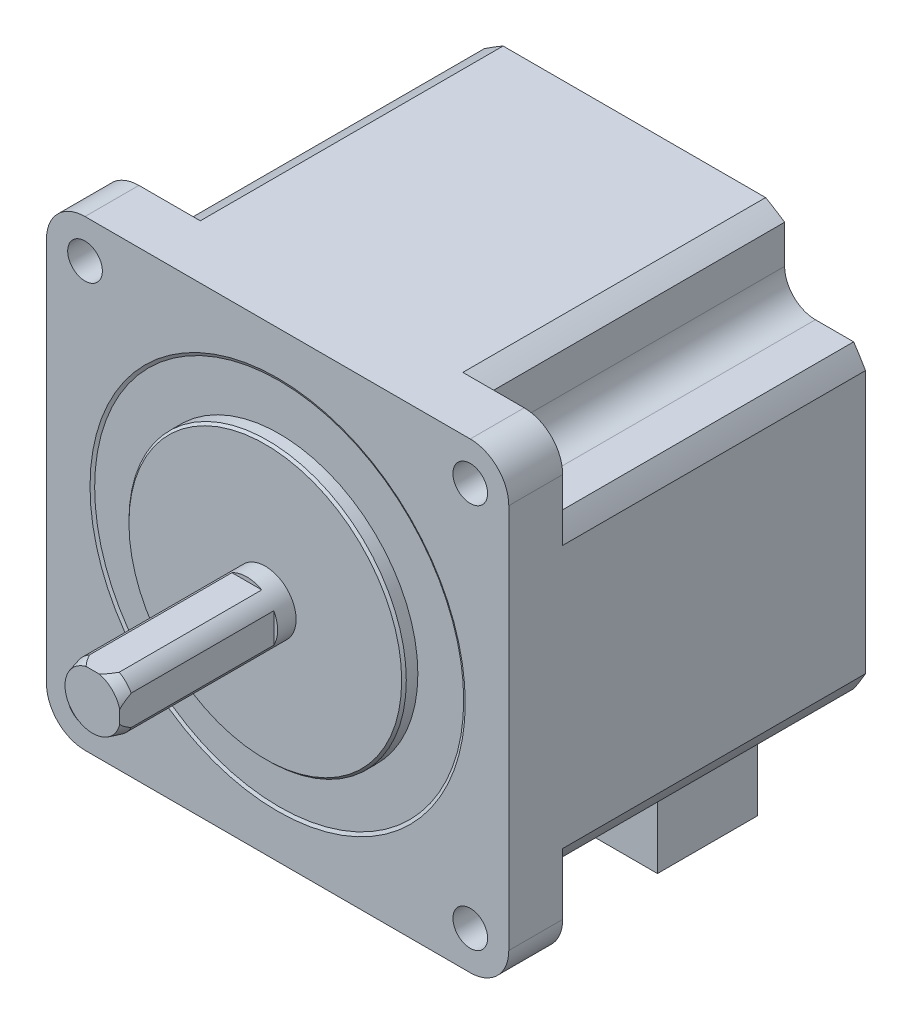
SolidWorks part; units mm, degrees
ref_plane "正面" through (0, 0, 0) normal (0, 0, 1) x (1, 0, 0)
ref_plane "平面" through (0, 0, 0) normal (0, 1, 0) x (1, 0, 0)
ref_plane "右側面" through (0, 0, 0) normal (1, 0, 0) x (0, 0, -1)
sketch "ｽｹｯﾁ1" plane through (0, 0, 0) normal (0, 0, 1) x (1, 0, 0)
  circle A0 centre (0, 0) radius 4
  dimension "D1" = 8
extrude "押し出し1" add sketch "ｽｹｯﾁ1" along normal blind 22.4
sketch "ｽｹｯﾁ2" plane through (0, 0, 0) normal (0, 0, -1) x (-1, 0, 0)
  circle A0 centre (0, 0) radius 18
  dimension "D1" = 36
extrude "押し出し2" add sketch "ｽｹｯﾁ2" along normal blind 1.6
sketch "ｽｹｯﾁ3" plane through (0, 0, -1.6) normal (0, 0, -1) x (-1, 0, 0)
  line L1 (-30, 30) -> (30, 30)
  line L2 (-30, 30) -> (-30, -30)
  line L3 (-30, -30) -> (30, -30)
  line L4 (30, 30) -> (30, -30)
  line L5 (-30, 30) -> (30, -30) construction
  line L6 (-30, -30) -> (30, 30) construction
  line L7 (25, 25) -> (-25, 25) construction
  line L8 (25, 25) -> (25, -25) construction
  line L9 (25, -25) -> (-25, -25) construction
  line L10 (-25, 25) -> (-25, -25) construction
  line L11 (25, 25) -> (-25, -25) construction
  line L12 (25, -25) -> (-25, 25) construction
  circle A0 centre (25, 25) radius 2.25
  circle A1 centre (-25, 25) radius 2.25
  circle A2 centre (25, -25) radius 2.25
  circle A3 centre (-25, -25) radius 2.25
  point P0 (0, 0)
  point P6 (0, 0)
  dimension "D3" = 50
  dimension "D4" = 50
  dimension "D6" = 4.5
  dimension "D1" = 60
  dimension "D2" = 60
extrude "押し出し3" add sketch "ｽｹｯﾁ3" along normal blind 7
fillet "Fillet1" radius 5 4 edges at (30, -30, -5.1) (-30, -30, -5.1) (-30, 30, -5.1) (30, 30, -5.1)
sketch "ｽｹｯﾁ4" plane through (0, 0, -8.6) normal (0, 0, -1) x (-1, 0, 0)
  line L0 (19.5, 19.5) -> (30, 19.5)
  line L1 (-19.5, 30) -> (19.5, 30)
  line L2 (-19.5, 30) -> (-19.5, 19.5)
  line L3 (-19.5, -30) -> (19.5, -30)
  line L4 (19.5, 30) -> (19.5, 19.5)
  line L5 (-19.5, 30) -> (19.5, -30) construction
  line L6 (-19.5, -30) -> (19.5, 30) construction
  line L7 (-30, 19.5) -> (-19.5, 19.5)
  line L8 (-30, 19.5) -> (-30, -19.5)
  line L9 (-30, -19.5) -> (-19.5, -19.5)
  line L10 (30, 19.5) -> (30, -19.5)
  line L11 (-30, 19.5) -> (30, -19.5) construction
  line L12 (-30, -19.5) -> (30, 19.5) construction
  line L13 (-19.5, -19.5) -> (-19.5, -30)
  line L14 (19.5, -19.5) -> (30, -19.5)
  line L15 (19.5, -19.5) -> (19.5, -30)
  circle A0 centre (0, 0) radius 34.5
  point P0 (0, 0)
  point P6 (0, 0)
  dimension "D5" = 69
  dimension "D1" = 39
  dimension "D2" = 60
  dimension "D3" = 60
  dimension "D4" = 39
extrude "押し出し4" add sketch "ｽｹｯﾁ4" along normal blind 39.3 contours L10 A0 L0 L4 L1 L2 L7 L8 L9 L13 L3 L15 L14
fillet "Fillet2" radius 4 4 edges at (19.5, -19.5, -28.25) (-19.5, -19.5, -28.25) (-19.5, 19.5, -28.25) (19.5, 19.5, -28.25)
sketch "Sketch1" plane through (0, -30, 0) normal (0, -1, 0) x (1, 0, 0)
  line L0 (17.0367, -47.9) -> (-17.0367, -47.9) construction
  line L1 (-16, -47.9) -> (16, -47.9)
  line L2 (-16, -47.9) -> (-16, -34.9)
  line L3 (-16, -34.9) -> (16, -34.9)
  line L4 (16, -47.9) -> (16, -34.9)
  dimension "D1" = 13
  dimension "D2" = 32
  dimension "D3" = 16
extrude "Extrude1" add sketch "Sketch1" along normal blind 10
chamfer "Chamfer1" distance 1.5 angle 15 1 edges at (4, 0, 22.4)
sketch "Sketch2" plane through (0, 0, 22.4) normal (0, 0, 1) x (1, 0, 0)
  line L1 (-4.7278, 5.1185) -> (3.4221, 5.1185)
  line L2 (-4.7278, 5.1185) -> (-4.7278, 3.5)
  line L3 (-4.7278, 3.5) -> (3.4221, 3.5)
  line L4 (3.4221, 5.1185) -> (3.4221, 3.5)
  line L5 (5.2412, 2.4413) -> (3.5, 2.4413)
  line L6 (5.2412, 2.4413) -> (5.2412, -4.2883)
  line L7 (5.2412, -4.2883) -> (3.5, -4.2883)
  line L8 (3.5, 2.4413) -> (3.5, -4.2883)
  dimension "D1" = 3.5
  dimension "D2" = 3.5
extrude "Extrude2" cut sketch "Sketch2" against normal blind 20
chamfer "Chamfer2" distance 0.3 angle 45 1 edges at (-18, 0, 0)
sketch "Sketch3" plane through (0, 0, -1.6) normal (0, 0, 1) x (1, 0, 0)
  circle A0 centre (0, 0) radius 18
  circle A1 centre (0, 0) radius 24.35
  dimension "D1" = 48.7
  dimension "D2" = 36
extrude "Extrude3" cut sketch "Sketch3" against normal blind 0.2
chamfer "Chamfer3" distance 0.2 distance2 0.4 1 edges at (24.35, 0, -1.8)
